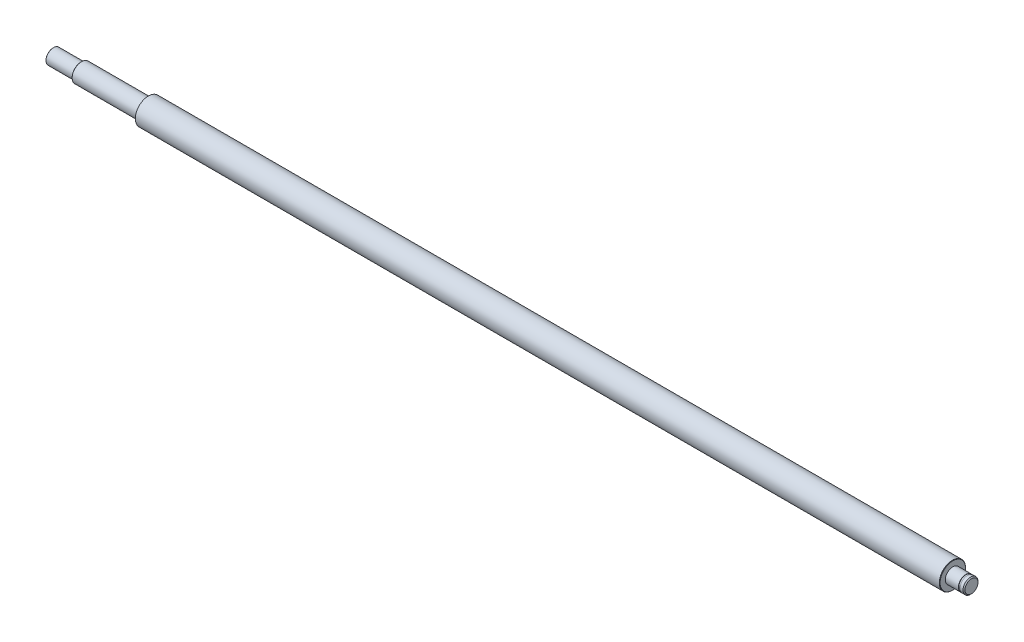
SolidWorks part; units mm, degrees
ref_plane "Plan1" through (0, 0, 0) normal (0, 0, 1) x (1, 0, 0)
ref_plane "Plan2" through (0, 0, 0) normal (0, 1, 0) x (1, 0, 0)
ref_plane "Plan3" through (0, 0, 0) normal (1, 0, 0) x (0, 0, -1)
sketch "Esquisse1" plane through (0, 0, 0) normal (0, 0, 1) x (1, 0, 0)
  line L0 (-39.8511, 0) -> (435.8794, 0) construction
  line L1 (55, 0) -> (-55, 0) construction
  line L2 (0, -55) -> (0, 55) construction
  line L3 (51, 7) -> (481.5, 7)
  line L4 (0, 4) -> (0, 0)
  line L5 (0, 0) -> (491.5, 0)
  line L6 (481.5, 7) -> (481.5, 4)
  line L7 (0, 4) -> (15, 4)
  line L8 (15, 4) -> (15, 5)
  line L9 (15, 5) -> (51, 5)
  line L10 (51, 5) -> (51, 7)
  line L11 (481.5, 4) -> (488.5, 4)
  line L12 (488.5, 4) -> (488.5, 3.8)
  line L13 (488.5, 3.8) -> (489.4, 3.8)
  line L14 (489.4, 3.8) -> (489.4, 4)
  line L15 (489.4, 4) -> (491, 4)
  line L16 (491.5, 3.5) -> (491.5, 0)
  line L17 (491, 4) -> (491.5, 3.5)
  dimension "D1" = 14
  dimension "D2" = 8
  dimension "D3" = 10
  dimension "D4" = 15
  dimension "D5" = 36
  dimension "D6" = 7.9
  dimension "D7" = 8
  dimension "D8" = 10
  dimension "D9" = 0.9
  dimension "D10" = 7.6
  dimension "D12" = 0.5
  dimension "D13" = 45
  dimension "D15" = 430.5
revolve "Révolution1" add sketch "Esquisse1" angle 360 about L0
chamfer "Chanfrein1" distance 0.2 angle 45 3 edges at (15, 0, 5) (0, 0, 4) (481.5, 0, 7)
